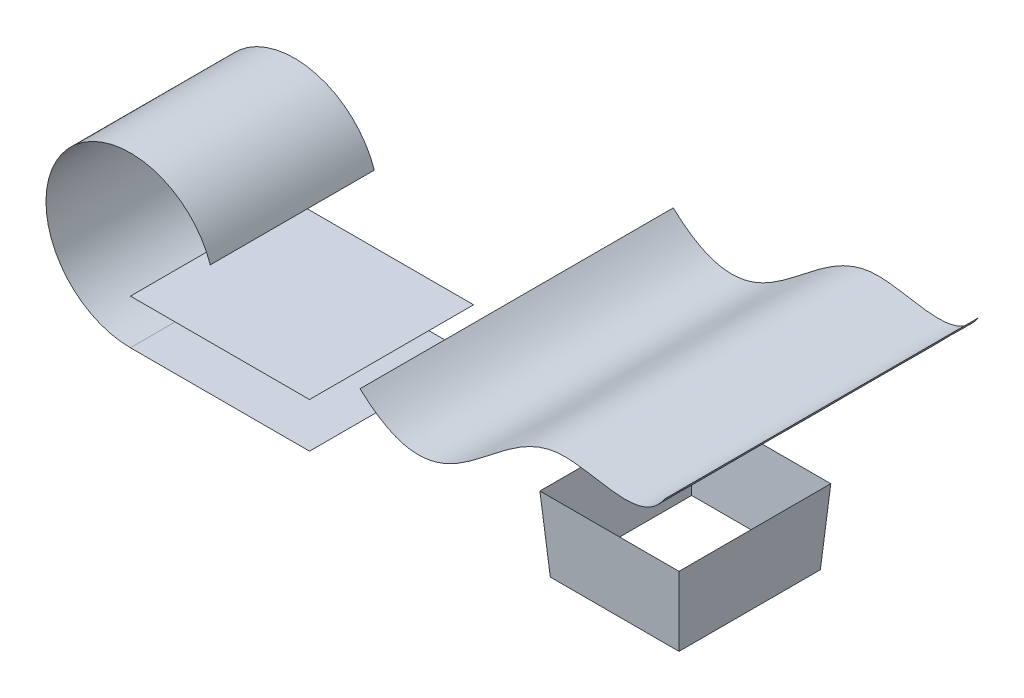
SolidWorks part; units mm, degrees
ref_plane "Front Plane" through (0, 0, 0) normal (0, 0, 1) x (1, 0, 0)
ref_plane "Top Plane" through (0, 0, 0) normal (0, 1, 0) x (1, 0, 0)
ref_plane "Right Plane" through (0, 0, 0) normal (1, 0, 0) x (0, 0, -1)
sketch "Sketch1" plane through (0, 0, 0) normal (0, 0, 1) x (1, 0, 0)
  line L0 (0, 0) -> (-60.042, 0)
  arc A0 (-60.042, 0) -> (-33.2677, 37.4573) centre (-60.042, 28.2977) cw
surface "Surface-Extrude1" sketch "Sketch1" parameters "D1"=55
surface "Surface-Offset1" parameters "D1"=15
sketch "Sketch2" plane through (0, 0, 0) normal (0, 1, 0) x (1, 0, 0)
  line L1 (120.0575, -23.6916) -> (76.9127, -23.6916)
  line L2 (120.0575, -23.6916) -> (120.0575, 23.6916)
  line L3 (120.0575, 23.6916) -> (76.9127, 23.6916)
  line L4 (76.9127, -23.6916) -> (76.9127, 23.6916)
  line L5 (120.0575, -23.6916) -> (76.9127, 23.6916) construction
  line L6 (120.0575, 23.6916) -> (76.9127, -23.6916) construction
  point P0 (98.4851, 0)
surface "Surface-Extrude2" sketch "Sketch2" parameters "D1"=25, "D3"=4
sketch "Sketch3" plane through (0, 0, 0) normal (0, 0, 1) x (1, 0, 0)
  spline S0 degree 3 poles (41.9383, 51.6035) (71.0393, 24.566) (92.0146, 84.7712) (135.818, 58.0274) (144.0932, 70.7057) knots 0 0 0 0 0.65597 1 1 1 1
surface "Surface-Extrude3" sketch "Sketch3" parameters "D1"=105
